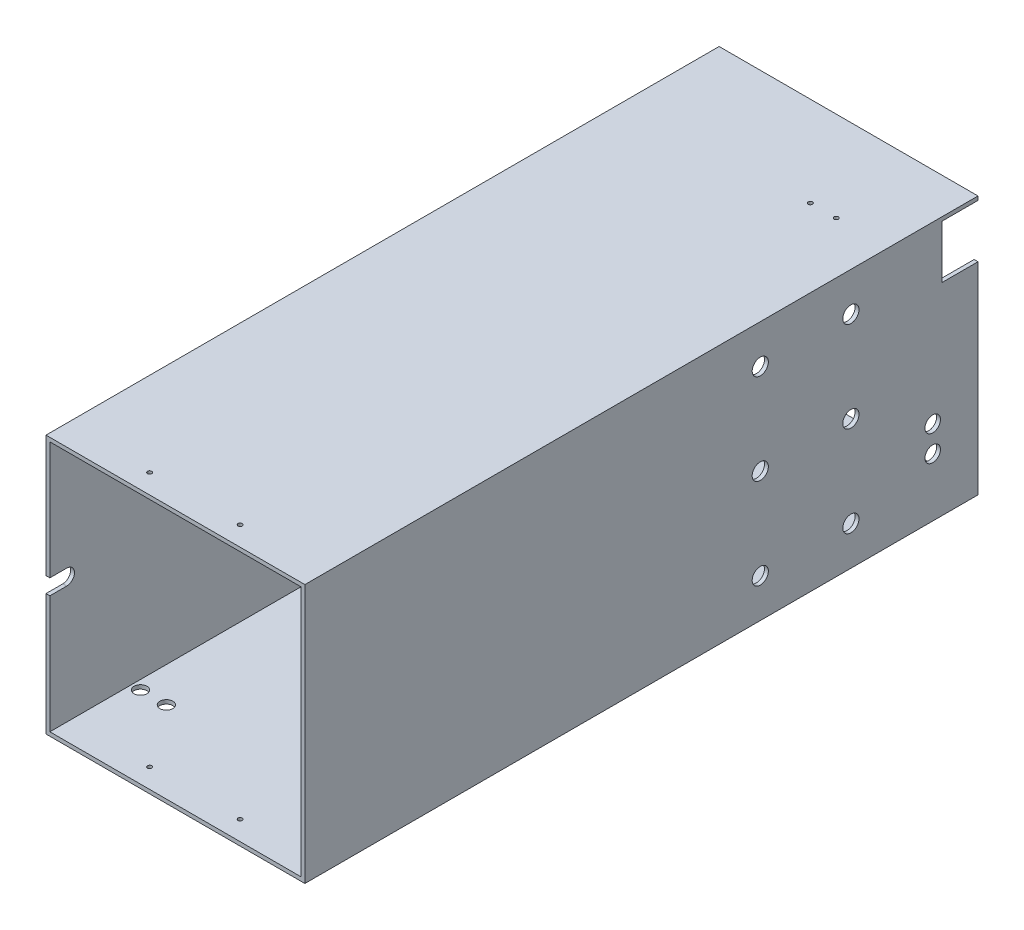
SolidWorks part; units mm, degrees
ref_plane "Plan de face" through (0, 0, 0) normal (0, 0, 1) x (1, 0, 0)
ref_plane "Plan de dessus" through (0, 0, 0) normal (0, 1, 0) x (1, 0, 0)
ref_plane "Plan de droite" through (0, 0, 0) normal (1, 0, 0) x (0, 0, -1)
sketch "Esquisse1" plane through (0, 0, 0) normal (0, 0, 1) x (1, 0, 0)
  line L0 (3, 3) -> (3, 197)
  line L1 (0, 0) -> (200, 0)
  line L2 (0, 0) -> (0, 200)
  line L3 (0, 200) -> (200, 200)
  line L4 (200, 0) -> (200, 200)
  line L5 (3, 197) -> (197, 197)
  line L6 (197, 3) -> (197, 197)
  line L7 (3, 3) -> (197, 3)
  dimension "D1" = 200
  dimension "D2" = 200
  dimension "D3" = 3
extrude "Extrusion1" add sketch "Esquisse1" along normal blind 520
sketch "Esquisse2" plane through (200, 0, 0) normal (1, 0, 0) x (0, 0, -1)
  line L0 (0, 0) -> (0, 200) construction
  line L1 (0, 197) -> (-28, 197)
  line L2 (0, 197) -> (0, 156)
  line L3 (0, 156) -> (-28, 156)
  line L4 (-28, 197) -> (-28, 156)
  line L5 (-520, 200) -> (0, 200) construction
  line L6 (-520, 0) -> (0, 0) construction
  line L8 (-520, 197) -> (0, 197) construction
  circle A0 centre (-35, 65) radius 6
  circle A1 centre (-35, 45) radius 6
  circle A12 centre (-98.2, 170) radius 6.25
  circle A13 centre (-168.2, 170) radius 6.25
  circle A14 centre (-98.2, 100) radius 6.25
  circle A15 centre (-168.2, 100) radius 6.25
  circle A16 centre (-98.2, 30) radius 6.25
  circle A17 centre (-168.2, 30) radius 6.25
  dimension "D1" = 20
  dimension "D2" = 12
  dimension "D3" = 12
  dimension "D4" = 35
  dimension "D5" = 45
  dimension "D6" = 98.2
  dimension "D7" = 70
  dimension "D8" = 70
  dimension "D10" = 12.5
  dimension "D11" = 12.5
  dimension "D12" = 12.5
  dimension "D13" = 70
  dimension "D14" = 12.5
  dimension "D15" = 12.5
  dimension "D16" = 12.5
  dimension "D9" = 100
  dimension "D17" = 28
  dimension "D18" = 41
extrude "Enlèv. mat.-Extru.1" cut sketch "Esquisse2" against normal up to next
sketch "Esquisse6" plane through (0, 200, 0) normal (0, 1, 0) x (1, 0, 0)
  line L8 (200, -520) -> (0, -520) construction
  line L9 (200, 0) -> (0, 0) construction
  line L10 (44, 0) -> (3, 0)
  line L11 (44, 0) -> (44, -28)
  line L12 (44, -28) -> (3, -28)
  line L13 (3, 0) -> (3, -28)
  line L14 (200, -520) -> (200, 0) construction
  line L15 (0, -520) -> (0, 0) construction
  line L17 (3, -520) -> (3, 0) construction
  circle A1 centre (135, -505) radius 0.5
  circle A3 centre (65, -505) radius 0.5
  circle A12 centre (160, -69.5) radius 0.5
  circle A13 centre (140, -69.5) radius 0.5
  circle A18 centre (10, -73) radius 5
  circle A19 centre (30, -73) radius 5
  circle A20 centre (10, -457) radius 5
  circle A21 centre (30, -457) radius 5
  dimension "D2" = 40
  dimension "D3" = 69.5
  dimension "D4" = 10
  dimension "D7" = 10
  dimension "D9" = 1
  dimension "D10" = 1
  dimension "D12" = 1
  dimension "D13" = 70
  dimension "D14" = 1
  dimension "D15" = 15
  dimension "D16" = 65
  dimension "D17" = 10
  dimension "D18" = 20
  dimension "D19" = 20
  dimension "D8" = 10
  dimension "D20" = 10
  dimension "D22" = 10
  dimension "D23" = 73
  dimension "D5" = 41
  dimension "D6" = 28
  dimension "D11" = 20
  dimension "D21" = 63
sketch "Esquisse7" plane through (0, 0, 0) normal (-1, 0, 0) x (0, 0, 1)
  line L0 (520, 200) -> (520, 0) construction
  line L1 (520, 200) -> (0, 200) construction
  line L2 (507, 106) -> (520, 106)
  line L3 (520, 106) -> (520, 94)
  line L4 (520, 94) -> (507, 94)
  line L5 (0, 200) -> (0, 0) construction
  line L6 (520, 0) -> (0, 0) construction
  arc A0 (507, 106) -> (507, 94) centre (507, 100) ccw
  circle A1 centre (35, 65) radius 2.5
  dimension "D1" = 12
  dimension "D2" = 13
  dimension "D5" = 65
  dimension "D6" = 5
  dimension "D3" = 100
  dimension "D4" = 35
extrude "Enlèv. mat.-Extru.4" cut sketch "Esquisse7" against normal up to next
sketch "Esquisse8" plane through (0, 0, 0) normal (0, -1, 0) x (1, 0, 0)
  line L4 (3, 0) -> (44, 0)
  line L5 (3, 28) -> (3, 0)
  line L6 (44, 28) -> (3, 28)
  line L7 (44, 0) -> (44, 28)
  line L8 (3, 0) -> (44, 0)
  line L9 (3, 28) -> (3, 0)
  line L10 (44, 28) -> (3, 28)
  line L11 (44, 0) -> (44, 28)
  circle A1 centre (10, 457) radius 5
  circle A2 centre (10, 457) radius 5
  circle A3 centre (30, 73) radius 5
  circle A4 centre (30, 73) radius 5
  circle A5 centre (10, 73) radius 5
  circle A6 centre (10, 73) radius 5
  circle A7 centre (65, 505) radius 0.5
  circle A8 centre (65, 505) radius 0.5
  circle A9 centre (135, 505) radius 0.5
  circle A10 centre (135, 505) radius 0.5
  circle A11 centre (30, 457) radius 5
  circle A12 centre (30, 457) radius 5
  circle A13 centre (140, 69.5) radius 0.5
  circle A14 centre (140, 69.5) radius 0.5
  circle A15 centre (160, 69.5) radius 0.5
  circle A16 centre (160, 69.5) radius 0.5
  dimension "D1" = 0
  dimension "D2" = 0
  dimension "D3" = 0
  dimension "D4" = 0
  dimension "D5" = 0
  dimension "D6" = 0
  dimension "D7" = 0
  dimension "D8" = 0
  dimension "D9" = 0
extrude "Enlèv. mat.-Extru.5" cut sketch "Esquisse8" against normal up to next
hole_wizard "Trou taraudé M41" positions "Esquisse3D1" profile "Esquisse9" tap size "M4" standard "ISO"
sketch3d "Esquisse3D1"
  line L0 (65, 3, 505) -> (65, 0, 505) construction
  line L1 (135, 3, 505) -> (135, 0, 505) construction
  line L2 (140, 3, 69.5) -> (140, 0, 69.5) construction
  line L3 (160, 3, 69.5) -> (160, 0, 69.5) construction
  point P0 (65, 0, 505)
  point P4 (135, 0, 505)
  point P8 (140, 0, 69.5)
  point P12 (160, 0, 69.5)
  point P16 (65, 200, 505)
  point P19 (135, 200, 505)
sketch "Esquisse9" plane through (65, 0, 505) normal (1, 0, 0) x (0, 0, -1)
  line L0 (0, 0) -> (0, 200)
  line L1 (0, 200) -> (1.65, 200)
  line L2 (1.65, 200) -> (1.65, 0)
  line L5 (1.65, 0) -> (0, 0)
  line L11 (0, -6.35) -> (0, 107.95) construction
  dimension "Diamètre du trou pour taraudage jusqu'au prochain" = 3.3
  dimension "Profondeur du trou pour taraudage jusqu'au prochain" = 200
